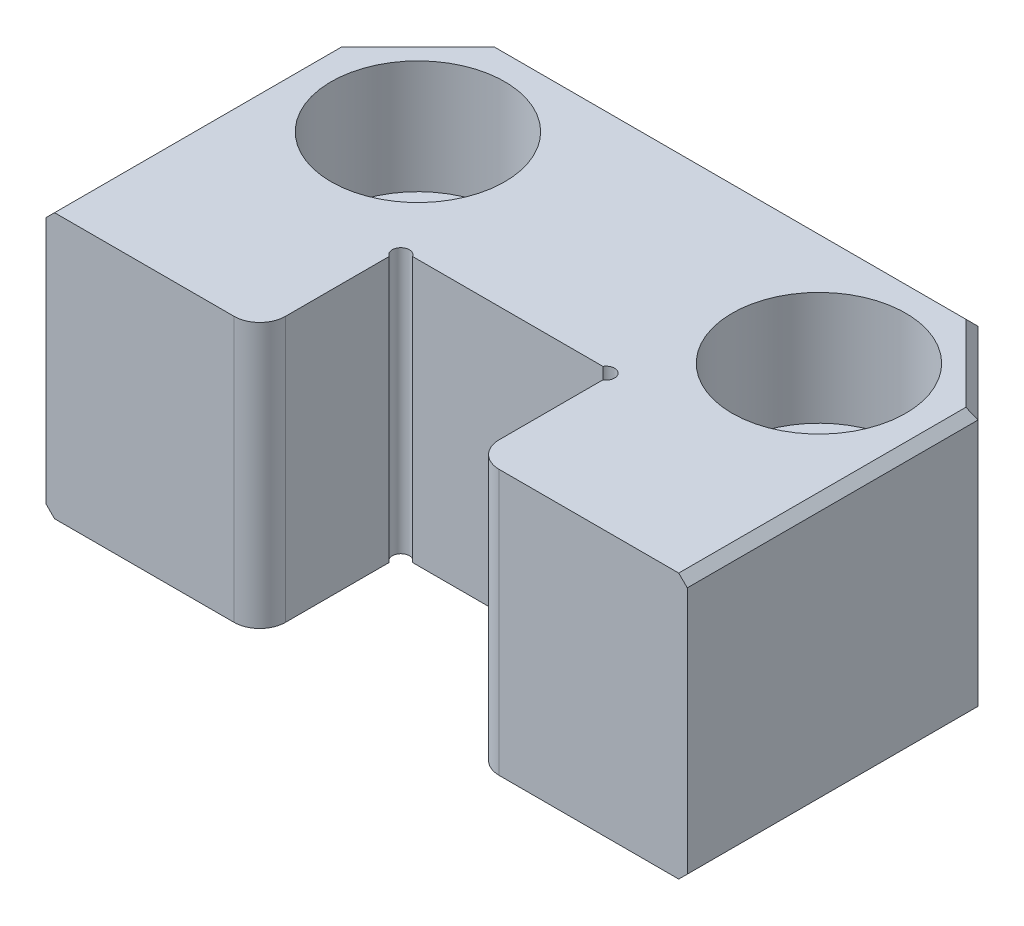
SolidWorks part; units mm, degrees
ref_plane "Front Plane" through (0, 0, 0) normal (0, 0, 1) x (1, 0, 0)
ref_plane "Top Plane" through (0, 0, 0) normal (0, 1, 0) x (1, 0, 0)
ref_plane "Right Plane" through (0, 0, 0) normal (1, 0, 0) x (0, 0, -1)
sketch "Sketch2" plane through (0, 0, 0) normal (0, 1, 0) x (1, 0, 0)
  line L0 (-55, 0) -> (55, 0) construction
  line L1 (-19.05, 22.098) -> (19.05, 22.098)
  line L2 (-19.05, 22.098) -> (-19.05, 0)
  line L3 (-19.05, 0) -> (19.05, 0)
  line L4 (19.05, 22.098) -> (19.05, 0)
  dimension "D1" = 38.1
  dimension "D2" = 22.098
  dimension "D3" = 19.05
extrude "Extrude1" add sketch "Sketch2" along normal blind 15.748
chamfer "Chamfer1" distance 4.826 angle 45 2 edges at (19.05, 7.874, -22.098) (-19.05, 7.874, -22.098)
sketch "Sketch3" plane through (0, 0, 0) normal (0, -1, 0) x (1, 0, 0)
  line L1 (-5.6561, -8.382) -> (5.6561, -8.382)
  line L2 (-6.35, -7.6881) -> (-6.35, 1.27)
  line L3 (-6.35, 1.27) -> (6.35, 1.27)
  line L4 (6.35, -7.6881) -> (6.35, 1.27)
  line L5 (0, -8.6614) -> (0, 8.6614) construction
  line L6 (-19.05, 0) -> (19.05, 0) construction
  arc A0 (-6.35, -7.6881) -> (-5.6561, -8.382) centre (-6.096, -8.128) ccw
  arc A2 (5.6561, -8.382) -> (6.35, -7.6881) centre (6.096, -8.128) ccw
  dimension "D4" = 0.254
  dimension "D5" = 1.016
  dimension "D8" = 1.016
  dimension "D1" = 0.254
  dimension "D2" = 8.382
  dimension "D3" = 6.35
  dimension "D6" = 0.254
  dimension "D7" = 0.254
  dimension "D9" = 12.7
  dimension "D10" = 9.652
extrude "Cut-Extrude1" cut sketch "Sketch3" against normal through all
fillet "Fillet1" radius 1.524 2 edges at (6.35, 7.874, 0) (-6.35, 7.874, 0)
sketch "Sketch4" plane through (0, 0, 0) normal (0, -1, 0) x (1, 0, 0)
  line L1 (14.224, -22.098) -> (-14.224, -22.098) construction
  line L3 (-19.05, -17.272) -> (-19.05, 0) construction
  line L4 (19.05, 0) -> (19.05, -17.272) construction
  circle A0 centre (11.9126, -14.9606) radius 3.5687
  circle A1 centre (-11.9126, -14.9606) radius 3.5687
  dimension "D5" = 7.1374
  dimension "D6" = 7.1374
  dimension "D1" = 7.1374
  dimension "D2" = 7.1374
  dimension "D3" = 7.1374
  dimension "D4" = 7.1374
extrude "Cut-Extrude2" cut sketch "Sketch4" against normal blind 15.748
sketch "Sketch5" plane through (0, 0, 0) normal (0, -1, 0) x (1, 0, 0)
  circle A1 centre (11.9126, -14.9606) radius 5.1562
  circle A3 centre (-11.9126, -14.9606) radius 5.1562
  dimension "D1" = 10.3124
  dimension "D2" = 10.3124
chamfer "Chamfer2" distance 0.508 angle 45 10 edges at (-19.05, 15.748, -8.636) (-16.637, 15.748, -19.685) (0, 15.748, -22.098) (16.637, 15.748, -19.685) (19.05, 15.748, -8.636) (19.05, 0, -8.636) (16.637, 0, -19.685) (0, 0, -22.098) (-16.637, 0, -19.685) (-19.05, 0, -8.636)
extrude "Cut-Extrude3" cut sketch "Sketch5" along normal blind 6.731 from surface at -15.748
